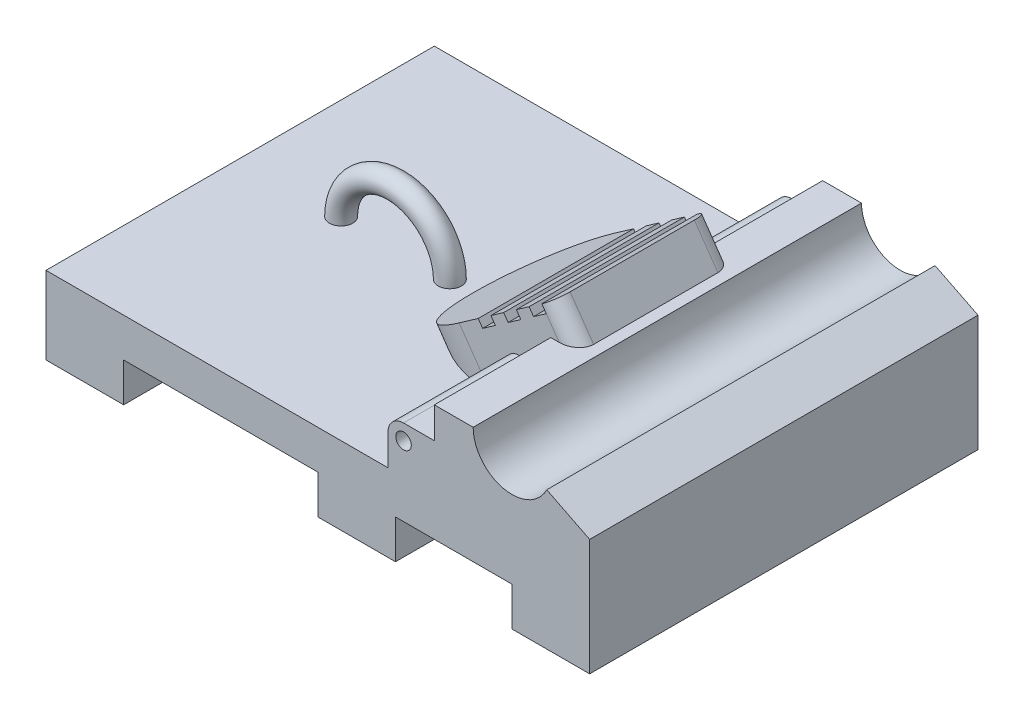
SolidWorks part; units mm, degrees
ref_plane "Front Plane" through (0, 0, 0) normal (0, 0, 1) x (1, 0, 0)
ref_plane "Top Plane" through (0, 0, 0) normal (0, 1, 0) x (1, 0, 0)
ref_plane "Right Plane" through (0, 0, 0) normal (1, 0, 0) x (0, 0, -1)
sketch "Sketch2" plane through (0, 0, 0) normal (0, 0, 1) x (1, 0, 0)
  line L0 (12.7, 0) -> (-12.7, 0)
  line L1 (12.7, 0) -> (12.7, 12.7)
  line L2 (12.7, 12.7) -> (50.8, 12.7)
  line L3 (50.8, 12.7) -> (50.8, 0)
  line L4 (50.8, 0) -> (76.2, 0)
  line L5 (76.2, 0) -> (76.2, 38.1)
  line L6 (76.2, 38.1) -> (50.8, 50.8)
  line L7 (50.8, 50.8) -> (25.4, 50.8)
  line L8 (25.4, 50.8) -> (25.4, 25.4)
  line L9 (25.4, 25.4) -> (-101.6, 25.4)
  line L10 (-101.6, 25.4) -> (-101.6, 0)
  line L11 (-101.6, 0) -> (-76.2, 0)
  line L12 (-76.2, 0) -> (-76.2, 12.7)
  line L13 (-76.2, 12.7) -> (-12.7, 12.7)
  line L14 (-12.7, 12.7) -> (-12.7, 0)
  point P0 (0, 0)
  point P4 (0, 0)
extrude "Boss-Extrude1" add sketch "Sketch2" along normal mid plane 127
fillet "Fillet1" radius 5.08 1 edges at (25.4, 25.4, 0)
sketch "Sketch3" plane through (0, 25.4, 0) normal (0, 1, 0) x (1, 0, 0)
  line L0 (-25.4, 34.9794) -> (-25.4, -28.6947) construction
  dimension "D1" = 25.4
ref_plane "Plane1" through (-20.2904, 28.9778, 0) normal (-0.5736, 0.8192, 0) x (0, 0, 1)
sketch "Sketch4" plane through (-20.2904, 28.9778, 0) normal (-0.5736, 0.8192, 0) x (0, 0, 1)
  line L0 (-34.9794, -6.2376) -> (28.6947, -6.2376) construction
  line L1 (-25.4, 19.1624) -> (-25.4, 57.2624)
  line L2 (-25.4, 57.2624) -> (25.4, 57.2624)
  line L3 (25.4, 57.2624) -> (25.4, 19.1624)
  arc A0 (-25.4, 19.1624) -> (25.4, 19.1624) centre (0, 19.1624) ccw
  dimension "D1" = 25.4
  dimension "D2" = 63.5
extrude "Boss-Extrude2" add sketch "Sketch4" against normal up to body
fillet "Fillet2" radius 5.08 2 edges at (30.475, 56.3111, -25.4) (30.475, 56.3111, 25.4)
sketch "Sketch5" plane through (-20.2904, 28.9778, 0) normal (-0.5736, 0.8192, 0) x (0.8192, 0.5736, 0)
  line L0 (49.9441, 25.4) -> (38.2891, 25.4) construction
  line L1 (47.1024, 25.4) -> (52.1824, 25.4)
  line L2 (47.1024, 25.4) -> (47.1024, -25.4)
  line L3 (47.1024, -25.4) -> (52.1824, -25.4)
  line L4 (52.1824, 25.4) -> (52.1824, -25.4)
  line L5 (19.1624, -25.4) -> (52.1824, -25.4) construction
  line L6 (57.2624, -20.32) -> (57.2624, 20.32) construction
  line L7 (36.9424, 25.4) -> (36.9424, -25.4)
  line L8 (42.0224, 25.4) -> (42.0224, -25.4)
  line L9 (36.9424, 25.4) -> (42.0224, 25.4)
  line L10 (36.9424, -25.4) -> (42.0224, -25.4)
  line L11 (26.7824, 25.4) -> (26.7824, -25.4)
  line L12 (31.8624, 25.4) -> (31.8624, -25.4)
  line L13 (26.7824, 25.4) -> (31.8624, 25.4)
  line L14 (26.7824, -25.4) -> (31.8624, -25.4)
  dimension "D1" = 5.08
  dimension "D2" = 5.08
  dimension "D4" = 5.08
  dimension "D3" = 3
extrude "Cut-Extrude1" cut sketch "Sketch5" against normal blind 2.54
sketch "Sketch6" plane through (0, 0, 0) normal (0, 0, 1) x (1, 0, 0)
  line L0 (20.32, 25.4) -> (-101.6, 25.4) construction
  arc A0 (-68.58, 25.4) -> (-33.02, 25.4) centre (-50.8, 25.4) cw
  dimension "D1" = 17.78
  dimension "D2" = 50.8
sweep "Sweep1" add path "Sketch6" parameters "D3"=7.62
sketch "Sketch17" plane through (0, 0, 63.5) normal (0, 0, 1) x (1, 0, 0)
  line L1 (20.32, 25.4) -> (10.2456, 25.4)
  line L2 (25.4, 30.48) -> (25.4, 40.64)
  line L3 (25.4, 40.64) -> (15.3256, 40.64)
  line L4 (10.2456, 25.4) -> (10.2456, 35.56)
  line L6 (5.6077, 25.4) -> (20.32, 25.4) construction
  line L7 (25.4, 30.48) -> (25.4, 50.8) construction
  arc A0 (20.32, 25.4) -> (25.4, 30.48) centre (20.32, 30.48) ccw
  arc A1 (15.3256, 40.64) -> (10.2456, 35.56) centre (15.3256, 35.56) ccw
  circle A2 centre (15.3256, 35.56) radius 2.54
  point P11 (25.4, 25.4)
  dimension "D3" = 5.08
  dimension "D4" = 5.08
  dimension "D1" = 15.1544
  dimension "D2" = 15.24
extrude "Boss-Extrude3" add sketch "Sketch17" against normal up to surface (127 mm away)
sketch "Sketch20" plane through (0, 0, 63.5) normal (0, 0, 1) x (1, 0, 0)
  line L0 (50.8, 50.8) -> (25.4, 50.8) construction
  line L1 (76.2, 38.1) -> (50.8, 50.8) construction
  arc A0 (38.1, 50.8) -> (62.1592, 45.1204) centre (50.8, 50.8) ccw
  dimension "D1" = 12.7
extrude "Cut-Extrude2" cut sketch "Sketch20" against normal through all both and the other way through all
equation "\"A\" = 7in"
equation "\"B\"= 5in"
equation "\"D1@Sketch2\"=\"A\""
equation "\"D1@Boss-Extrude1\"=\"B\""
